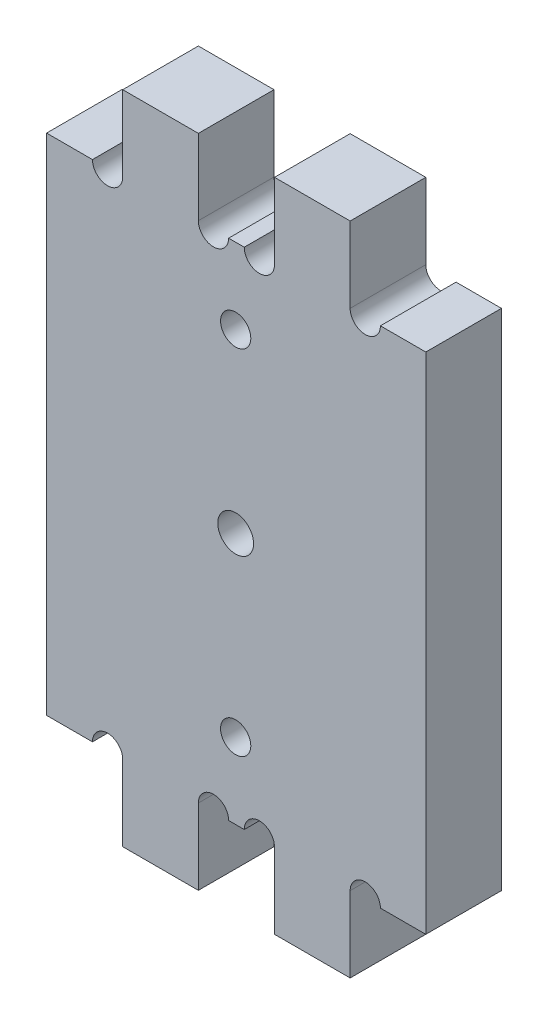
SolidWorks part; units mm, degrees
ref_plane "Ebene vorne" through (0, 0, 0) normal (0, 0, 1) x (1, 0, 0)
ref_plane "Ebene oben" through (0, 0, 0) normal (0, 1, 0) x (1, 0, 0)
ref_plane "Ebene rechts" through (0, 0, 0) normal (1, 0, 0) x (0, 0, -1)
sketch "Skizze1" plane through (0, 0, 0) normal (0, 0, 1) x (1, 0, 0)
  line L0 (0, 0) -> (0, 100)
  line L1 (0, 100) -> (-9, 100)
  line L2 (-15, 100) -> (-15, 115)
  line L5 (-15, 115) -> (-30, 115)
  line L6 (-30, 115) -> (-30, 100)
  line L7 (-36, 100) -> (-39.1, 100)
  line L8 (-45.1, 100) -> (-45.1, 115)
  line L9 (-45.1, 115) -> (-60.1, 115)
  line L10 (-60.1, 115) -> (-60.1, 100)
  line L12 (-66.1, 100) -> (-75.2, 100)
  line L13 (-75.2, 100) -> (-75.2, 0)
  line L14 (-75.2, 0) -> (-66.1, 0)
  line L15 (-60.1, 0) -> (-60.1, -15)
  line L16 (-60.1, -15) -> (-45.1, -15)
  line L17 (-45.1, -15) -> (-45.1, 0)
  line L18 (-36, 0) -> (-39.1, 0)
  line L19 (-30, 0) -> (-30, -15)
  line L20 (-30, -15) -> (-15, -15)
  line L21 (-15, -15) -> (-15, 0)
  line L22 (0, 0) -> (-9, 0)
  arc A0 (-9, 100) -> (-15, 100) centre (-12, 100) cw
  arc A1 (-30, 100) -> (-36, 100) centre (-33, 100) cw
  arc A2 (-39.1, 100) -> (-45.1, 100) centre (-42.1, 100) cw
  arc A3 (-60.1, 100) -> (-66.1, 100) centre (-63.1, 100) cw
  arc A4 (-9, 0) -> (-15, 0) centre (-12, 0) ccw
  arc A5 (-36, 0) -> (-30, 0) centre (-33, 0) cw
  arc A6 (-39.1, 0) -> (-45.1, 0) centre (-42.1, 0) ccw
  arc A7 (-60.1, 0) -> (-66.1, 0) centre (-63.1, 0) ccw
  dimension "D13" = 3
  dimension "D14" = 15
  dimension "D15" = 15
  dimension "D16" = 15
  dimension "D17" = 15
  dimension "D18" = 15
  dimension "D12" = 3
  dimension "D19" = 15
  dimension "D20" = 15.1
  dimension "D21" = 15
  dimension "D22" = 15
  dimension "D23" = 15
  dimension "D1" = 3
  dimension "D2" = 3
  dimension "D3" = 3
  dimension "D4" = 3
  dimension "D10" = 3
  dimension "D11" = 3
  dimension "D5" = 15
  dimension "D6" = 15.1
  dimension "D7" = 15
  dimension "D8" = 15
  dimension "D9" = 15.1
  dimension "D24" = 15
  dimension "D25" = 100
  dimension "D26" = 100
  dimension "D27" = 130
  dimension "D28" = 130
  dimension "D29" = 15
extrude "Aufsatz-Linear austragen1" add sketch "Skizze1" along normal blind 15
sketch "Skizze2" plane through (0, 0, 0) normal (0, 0, -1) x (-1, 0, 0)
  line L2 (36, 0) -> (39.1, 0) construction
  line L3 (75.2, 100) -> (75.2, 0) construction
  circle A0 centre (37.7, 85) radius 5.05
  circle A1 centre (37.7, 15) radius 5.05
  dimension "D1" = 10.1
  dimension "D2" = 10.1
  dimension "D3" = 15
  dimension "D5" = 37.5
  dimension "D4" = 70
extrude "Schnitt-Linear austragen2" cut sketch "Skizze2" against normal blind 7.5
sketch "Skizze3" plane through (0, 0, 0) normal (0, 0, -1) x (-1, 0, 0)
  line L1 (75.2, 100) -> (75.2, 0) construction
  circle A0 centre (37.7, 50) radius 3.55
  circle A1 centre (37.7, 85) radius 5.05 construction
  circle A2 centre (37.7, 85) radius 3
  circle A3 centre (37.7, 15) radius 3
  dimension "D1" = 35
  dimension "D2" = 7.1
  dimension "D3" = 37.5
  dimension "D4" = 6
  dimension "D5" = 6
extrude "Schnitt-Linear austragen3" cut sketch "Skizze3" against normal blind 17.5
